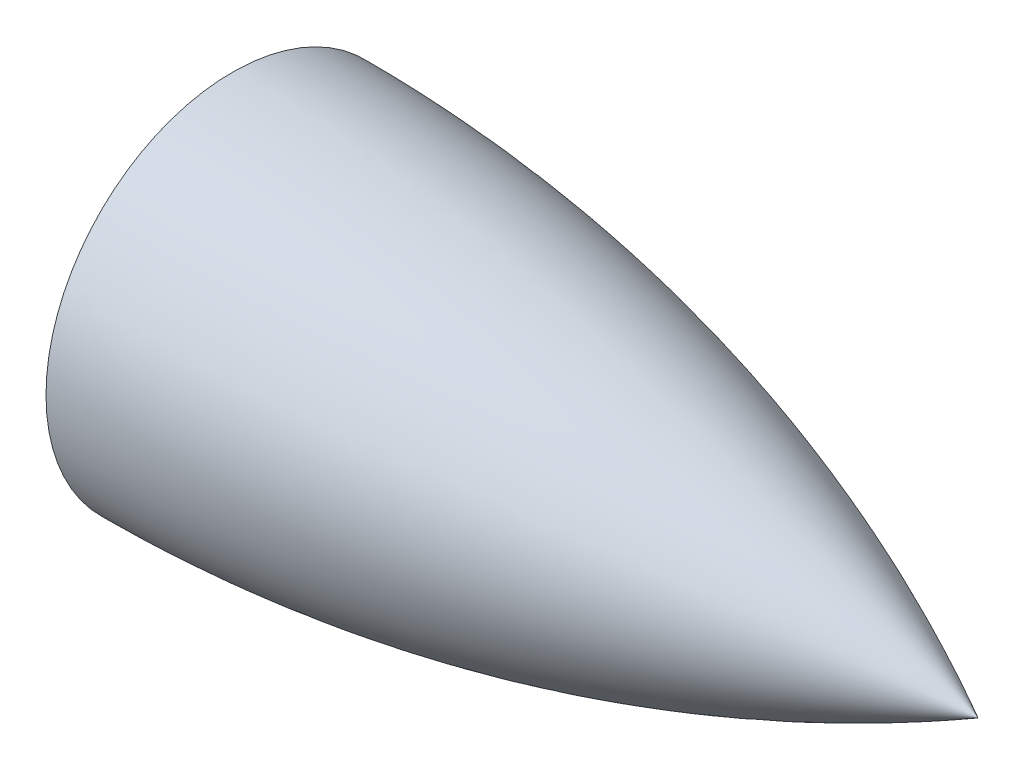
SolidWorks part; units mm, degrees
ref_plane "Front Plane" through (0, 0, 0) normal (0, 0, 1) x (1, 0, 0)
ref_plane "Top Plane" through (0, 0, 0) normal (0, 1, 0) x (1, 0, 0)
ref_plane "Right Plane" through (0, 0, 0) normal (1, 0, 0) x (0, 0, -1)
sketch "Tangent Ogive Profile" plane through (0, 0, 0) normal (0, 0, 1) x (1, 0, 0)
  line L0 (0, 0) -> (304.8, 0)
  line L1 (0, 0) -> (0, 76.2)
  line L2 (0, 76.2) -> (381, 76.2) construction
  line L3 (304.8, 0) -> (381, 0) construction
  arc A2 (0, 76.2) -> (304.8, 0) centre (0, -571.5) cw
  point P3 (304.8, 0)
sketch "Spherically Blunted Tangent Ogive Profile" plane through (0, 0, 0) normal (0, 0, 1) x (1, 0, 0)
  line L0 (0, 0) -> (0, 76.2) construction
  line L1 (0, 0) -> (0, 76.2)
  line L2 (0, 0) -> (304.8, 0) construction
  line L3 (0, 0) -> (271.6621, 0)
  line L4 (271.6621, 0) -> (304.8, 0) construction
  arc A0 (304.8, 0) -> (0, 76.2) centre (0, -571.5) ccw construction
  arc A1 (256.3137, 23.3265) -> (0, 76.2) centre (0, -571.5) ccw
  arc A2 (271.6621, 0) -> (256.3137, 23.3265) centre (246.2621, 0) ccw
  arc A3 (256.3137, 23.3265) -> (220.8621, 0) centre (246.2621, 0) ccw construction
  arc A4 (220.8621, 0) -> (271.6621, 0) centre (246.2621, 0) ccw construction
  arc A5 (304.8, 0) -> (256.3137, 23.3265) centre (0, -571.5) ccw construction
  point P4 (256.3137, 23.3265)
revolve "Tangent Ogive" add sketch "Tangent Ogive Profile" angle 360 about L0
revolve "Spherically Blunted Tangent Ogive" [suppressed] add sketch "Spherically Blunted Tangent Ogive Profile" angle 360 about L4
equation "\"R\"= 3'Base radius of nose cone"
equation "\"L\"= 12'Length of nose cone"
equation "\"rho\"= ( \"R\" ^ 2 + \"L\" ^ 2 ) / ( 2 * \"R\" )'Ogive radius"
equation "\"D2@Tangent Ogive Profile\" = \"L\""
equation "\"D1@Tangent Ogive Profile\" = \"R\""
equation "\"D4@Tangent Ogive Profile\" = \"rho\""
equation "\"r_n\"= 1'Radius of the capping shpere"
equation "\"x_0\"= \"L\" - sqr ( ( \"rho\" - \"r_n\" ) ^ 2 - ( \"rho\" - \"R\" ) ^ 2 )'X-coordinate of the center point of the capping sphere"
equation "\"y_t\"= ( \"r_n\" * ( \"rho\" - \"R\" ) ) / ( \"rho\" - \"r_n\" )'Y-coordinate of the tangency point of the capping sphere with the ogive"
equation "\"x_t\"= \"x_0\" - sqr ( \"r_n\" ^ 2 - \"y_t\" ^ 2 )'X-coordinate of the tangency point of the capping sphere with the ogive"
equation "\"x_a\"= \"x_0\" - \"r_n\"'X-coordinate of the apex point of the capping sphere relative to the pointy tip of the un-capped nosecone"
equation "\"D1@Spherically Blunted Tangent Ogive Profile\" = \"x_t\""
equation "\"D2@Spherically Blunted Tangent Ogive Profile\" = \"x_0\""
